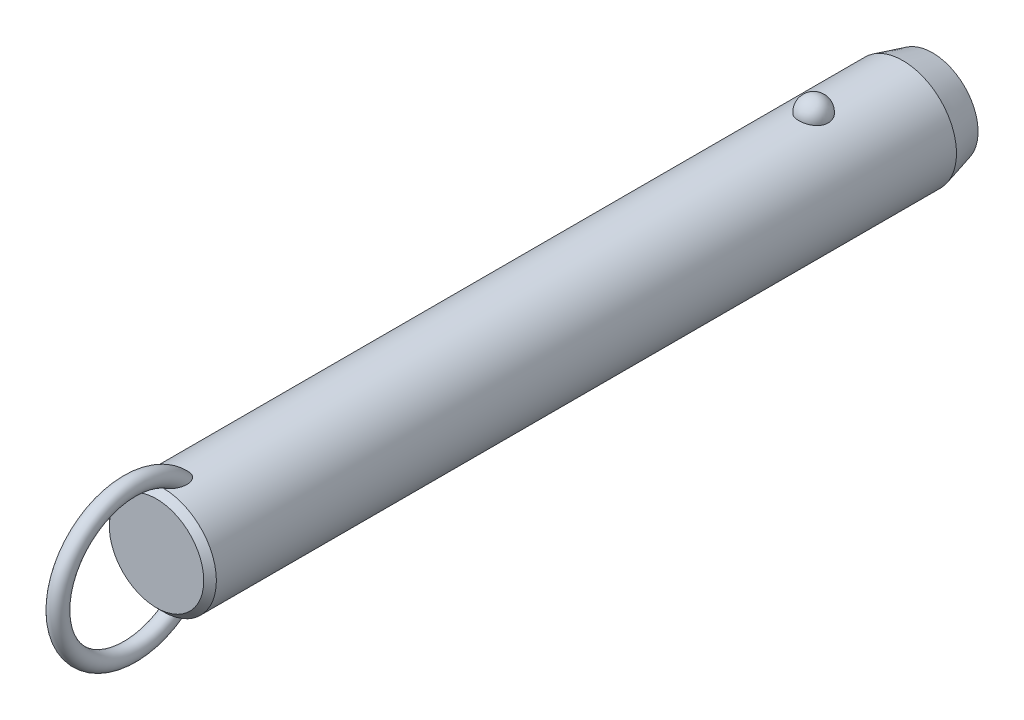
SolidWorks part; units mm, degrees
ref_plane "Front Plane" through (0, 0, 0) normal (0, 0, 1) x (1, 0, 0)
ref_plane "Top Plane" through (0, 0, 0) normal (0, 1, 0) x (1, 0, 0)
ref_plane "Right Plane" through (0, 0, 0) normal (1, 0, 0) x (0, 0, -1)
sketch "Sketch2" plane through (0, 0, 0) normal (0, 0, 1) x (1, 0, 0)
  circle A0 centre (0, 0) radius 12.7
  point P3 (0, 12.7)
  dimension "D1" = 25.4
extrude "Boss-Extrude1" add sketch "Sketch2" along normal blind 139.7
sketch "Sketch3" plane through (0, 0, 0) normal (0, 0, -1) x (-1, 0, 0)
  circle A0 centre (0, 0) radius 12.7
  dimension "D1" = 25.4
extrude "Boss-Extrude2" add sketch "Sketch3" along normal blind 31.7
chamfer "Chamfer1" distance 7 angle 15 1 edges at (-12.7, 0, -31.7)
sketch "Sketch12" plane through (0, 0, 0) normal (1, 0, 0) x (0, 0, -1)
  line L0 (-139.7, 12.7) -> (-139.7, -12.7) construction
  point P0 (-139.7, 0)
sketch "Sketch13" plane through (0, 0, 0) normal (1, 0, 0) x (0, 0, -1)
  circle A0 centre (-158.75, 0) radius 19.05
  point P2 (-139.7, 0)
  dimension "D1" = 38.1
sketch "Sketch14" plane through (0, 0, 0) normal (0, 1, 0) x (1, 0, 0)
  circle A0 centre (0, -141.7) radius 2
  point P2 (0, -139.7)
  dimension "D1" = 4
sweep "Sweep1" add profiles "Sketch14" path "Sketch13"
sketch "Sketch15" plane through (0, 0, 139.7) normal (0, 0, 1) x (1, 0, 0)
  circle A0 centre (0, 0) radius 12.7
  dimension "D1" = 25.4
extrude "Boss-Extrude3" add sketch "Sketch15" along normal blind 12.7
chamfer "Chamfer2" distance 1.5 angle 45 1 edges at (12.7, 0, 152.4)
sketch "Sketch18" plane through (0, 0, 0) normal (1, 0, 0) x (0, 0, -1)
  line L0 (24.7, 12.7) -> (-144.551, 12.7) construction
  line L1 (3.5, 16.2) -> (3.5, 9.2)
  line L2 (-144.551, -12.7) -> (24.7, -12.7) construction
  arc A0 (3.5, 16.2) -> (3.5, 9.2) centre (3.5, 12.7) ccw
  point P4 (0, 12.7)
  dimension "D1" = 28.9
revolve "Revolve1" add sketch "Sketch18" angle 360 about L1
